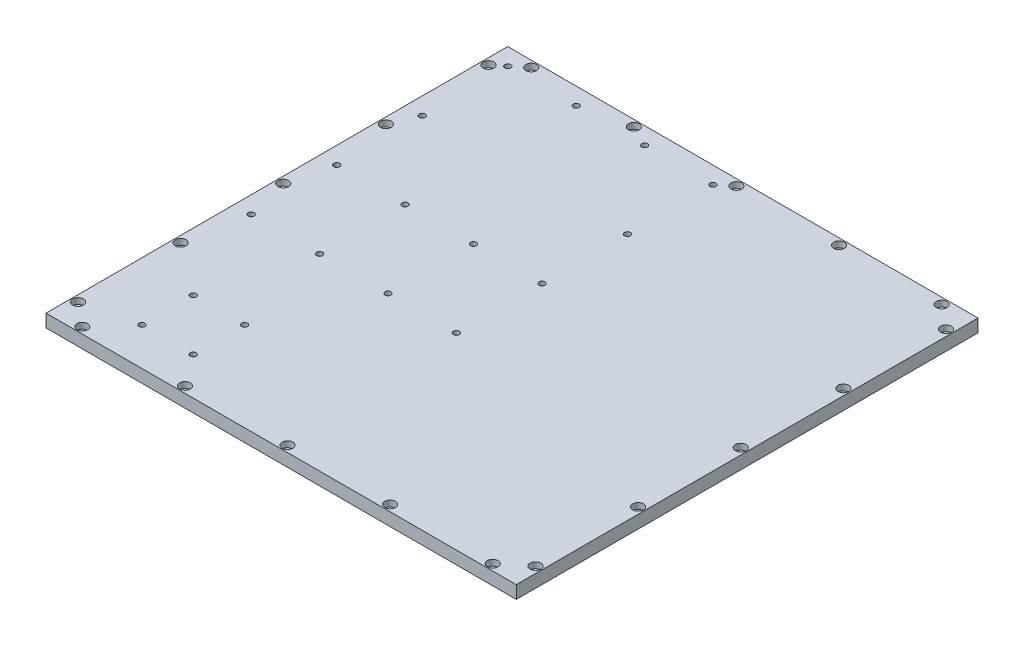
SolidWorks part; units mm, degrees
ref_plane "Front Plane" through (0, 0, 0) normal (0, 0, 1) x (1, 0, 0)
ref_plane "Top Plane" through (0, 0, 0) normal (0, 1, 0) x (1, 0, 0)
ref_plane "Right Plane" through (0, 0, 0) normal (1, 0, 0) x (0, 0, -1)
sketch "Sketch1" plane through (0, 0, 0) normal (0, 1, 0) x (1, 0, 0)
  line L1 (-174.625, 171.45) -> (174.625, 171.45)
  line L2 (-174.625, 171.45) -> (-174.625, -171.45)
  line L3 (-174.625, -171.45) -> (174.625, -171.45)
  line L4 (174.625, 171.45) -> (174.625, -171.45)
  line L5 (-174.625, 171.45) -> (174.625, -171.45) construction
  line L6 (-174.625, -171.45) -> (174.625, 171.45) construction
  point P0 (0, 0)
  dimension "D1" = 342.9
  dimension "D2" = 349.25
extrude "Boss-Extrude1" add sketch "Sketch1" along normal blind 9.525
sketch "Sketch2" plane through (0, 9.525, 0) normal (0, 1, 0) x (1, 0, 0)
  line L0 (0, 171.45) -> (0, -171.45) construction
  line L1 (174.625, 171.45) -> (-174.625, 171.45) construction
  line L2 (-174.625, -171.45) -> (174.625, -171.45) construction
  line L3 (-174.625, 0) -> (174.625, 0) construction
  line L4 (-174.625, 171.45) -> (-174.625, -171.45) construction
  line L5 (174.625, -171.45) -> (174.625, 171.45) construction
  line L6 (169.8625, 166.6875) -> (169.8625, -166.6875) construction
  line L7 (-169.8625, -166.6875) -> (169.8625, -166.6875) construction
  line L8 (-169.8625, 166.6875) -> (-169.8625, -166.6875) construction
  line L9 (-169.8625, 166.6875) -> (169.8625, 166.6875) construction
  circle A0 centre (0, -166.6875) radius 3.9687 construction
  circle A1 centre (76.2, -166.6875) radius 3.9688 construction
  circle A2 centre (152.4, -166.6875) radius 3.9687 construction
  circle A4 centre (-76.2, -166.6875) radius 3.9688 construction
  circle A5 centre (-152.4, -166.6875) radius 3.9687 construction
  circle A7 centre (-169.8625, 0) radius 3.9687 construction
  circle A8 centre (-169.8625, 76.2) radius 3.9687 construction
  circle A9 centre (-169.8625, 152.4) radius 3.9687 construction
  circle A11 centre (-169.8625, -76.2) radius 3.9687 construction
  circle A12 centre (-169.8625, -152.4) radius 3.9687 construction
  circle A14 centre (169.8625, -152.4) radius 3.9687 construction
  circle A15 centre (169.8625, -152.4) radius 3.9687 construction
  circle A16 centre (169.8625, -76.2) radius 3.9687 construction
  circle A17 centre (169.8625, 152.4) radius 3.9687 construction
  circle A18 centre (169.8625, 152.4) radius 3.9687 construction
  circle A19 centre (169.8625, 76.2) radius 3.9687 construction
  circle A20 centre (169.8625, 0) radius 3.9687 construction
  circle A21 centre (-152.4, 166.6875) radius 3.9687 construction
  circle A22 centre (-152.4, 166.6875) radius 3.9687 construction
  circle A23 centre (-76.2, 166.6875) radius 3.9687 construction
  circle A24 centre (152.4, 166.6875) radius 3.9687 construction
  circle A25 centre (152.4, 166.6875) radius 3.9687 construction
  circle A26 centre (76.2, 166.6875) radius 3.9687 construction
  circle A27 centre (0, 166.6875) radius 3.9687 construction
  dimension "D5" = 7.9375
  dimension "D8" = 7.9375
  dimension "D1" = 4.7625
  dimension "D2" = 4.7625
  dimension "D3" = 4.7625
  dimension "D4" = 4.7625
  dimension "D6" = 3
  dimension "D7" = 3
  dimension "D9" = 3
  dimension "D10" = 3
hole_wizard "CBORE for #8 Binding Head Machine Screw1" positions "Sketch3" profile "Sketch4" counterbore size "#8" standard "ANSI Inch"
sketch "Sketch3" plane through (0, 9.525, 0) normal (0, 1, 0) x (1, 0, 0)
  point P0 (-152.4, 166.6875)
  point P3 (-169.8625, 152.4)
  point P6 (-169.8625, 152.4)
  point P9 (-169.8625, 76.2)
  point P12 (-169.8625, 0)
  point P15 (-169.8625, -76.2)
  point P18 (-169.8625, -152.4)
  point P21 (-169.8625, -152.4)
  point P24 (-152.4, -166.6875)
  point P27 (-152.4, -166.6875)
  point P30 (-76.2, -166.6875)
  point P33 (0, -166.6875)
  point P36 (-152.4, 166.6875)
  point P39 (-76.2, 166.6875)
  point P42 (0, 166.6875)
  point P45 (76.2, 166.6875)
  point P48 (152.4, 166.6875)
  point P51 (152.4, 166.6875)
  point P54 (169.8625, 152.4)
  point P57 (169.8625, 152.4)
  point P60 (169.8625, 76.2)
  point P63 (169.8625, 0)
  point P66 (169.8625, -76.2)
  point P69 (169.8625, -152.4)
  point P72 (76.2, -166.6875)
  point P75 (152.4, -166.6875)
  point P78 (152.4, -166.6875)
  point P81 (169.8625, -152.4)
sketch "Sketch4" plane through (-152.4, 9.525, -166.6875) normal (1, 0, 0) x (0, 0, 1)
  line L0 (0, 0) -> (0, 9.525)
  line L1 (0, 9.525) -> (2.1526, 9.525)
  line L3 (2.1526, 9.525) -> (2.1527, 4.4196)
  line L4 (2.1527, 4.4196) -> (3.9687, 4.4196)
  line L5 (3.9687, 4.4196) -> (3.9687, 0)
  line L7 (3.9687, 0) -> (0, 0)
  line L11 (0, -6.35) -> (0, 107.95) construction
  dimension "Thru Hole Dia." = 4.3053
  dimension "Thru Hole Depth" = 9.525
  dimension "C'Bore Dia." = 7.9375
  dimension "C'Bore Depth" = 4.4196
sketch "Sketch5" plane through (0, 9.525, 0) normal (0, 1, 0) x (1, 0, 0)
  circle A0 centre (-9.525, 158.75) radius 2.1971
  circle A1 centre (-60.325, 158.75) radius 2.1971
  circle A2 centre (-111.125, 158.75) radius 2.1971
  circle A3 centre (-161.925, 158.75) radius 2.1971
  circle A4 centre (-9.525, 95.25) radius 2.1971
  circle A5 centre (-161.925, 95.25) radius 2.1971
  circle A6 centre (-161.925, 31.75) radius 2.1971
  circle A7 centre (-111.125, 31.75) radius 2.1971
  circle A8 centre (-60.325, 31.75) radius 2.1971
  circle A9 centre (-9.525, 31.75) radius 2.1971
  circle A11 centre (-161.925, -31.75) radius 2.1971
  circle A12 centre (-111.125, -31.75) radius 2.1971
  circle A13 centre (-60.325, -31.75) radius 2.1971
  circle A14 centre (-9.525, -31.75) radius 2.1971
extrude "Cut-Extrude1" cut sketch "Sketch5" against normal through all
sketch "Sketch6" plane through (0, 9.525, 0) normal (0, 1, 0) x (1, 0, 0)
  circle A0 centre (-93.353, -105.2721) radius 2.1971
  circle A1 centre (-93.353, -143.3721) radius 2.1971
  circle A2 centre (-131.453, -105.2721) radius 2.1971
  circle A3 centre (-131.453, -143.3721) radius 2.1971
extrude "Cut-Extrude2" cut sketch "Sketch6" against normal through all
